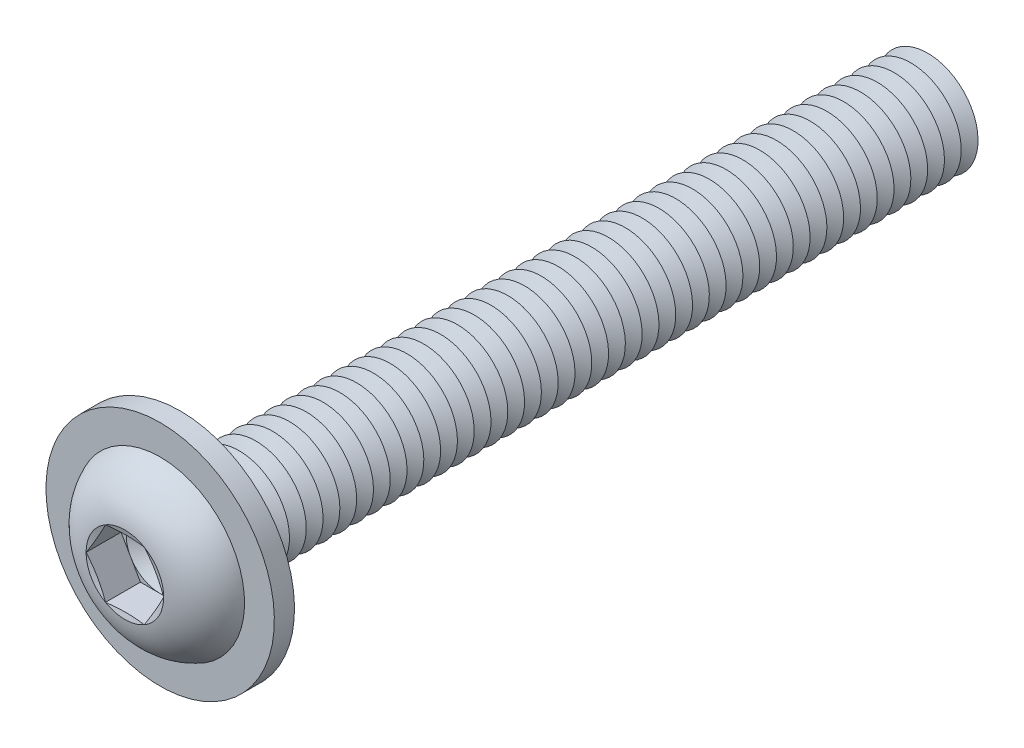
SolidWorks part; units mm, degrees
ref_plane "Front Plane" through (0, 0, 0) normal (0, 0, 1) x (1, 0, 0)
ref_plane "Top Plane" through (0, 0, 0) normal (0, 1, 0) x (1, 0, 0)
ref_plane "Right Plane" through (0, 0, 0) normal (1, 0, 0) x (0, 0, -1)
sketch "Sketch1" plane through (0, 0, 0) normal (1, 0, 0) x (0, 0, -1)
  line L0 (0, 3) -> (0, 5.25)
  line L3 (0, 3) -> (45, 3)
  line L4 (45, 3) -> (45, 0)
  line L5 (45, 0) -> (-3.3, 0) construction
  line L6 (-3.3, 0) -> (45, 0)
  line L7 (-3.3, 2.3094) -> (-3.3, 1.1547) construction
  line L8 (-3.3, 1.1547) -> (-3.3, 0)
  line L9 (-3.3, 2.3094) -> (-2.9906, 1.1547)
  line L10 (-2.9906, 1.1547) -> (-3.3, 1.1547)
  line L11 (45, 0) -> (22.7481, 0) construction
  line L12 (0, 5.25) -> (-3.3, 5.25) construction
  arc A1 (0, 5.25) -> (-3.3, 2.3094) centre (0, 1.928) ccw
  point P8 (45, 1.5)
  dimension "D1" = 10.5
  dimension "D2" = 6
  dimension "D3" = 3.3
  dimension "D4" = 4.6188
  dimension "D5" = 45
  dimension "D6" = 15
revolve "Revolve1" add sketch "Sketch1" angle 360 about L5
fillet "Fillet1" radius 0.5 1 edges at (0, 3, 0)
sketch "Sketch2" plane through (0, 0, 0) normal (1, 0, 0) x (0, 0, -1)
  line L0 (44.5, 3) -> (45.5, 3)
  line L1 (45, 3) -> (0.5, 3) construction
  line L2 (45.5, 3) -> (45, 2.134)
  line L3 (45, -3) -> (45, 3) construction
  line L4 (45, 2.134) -> (44.5, 3)
  dimension "D1" = 1
revolve "Cut-Revolve1" cut sketch "Sketch2" angle 360 about axis through (0, 0, -45) along (0, 0, -1)
pattern_linear "LPattern1" count 45 spacing 1 along (0, 0, 1) of "Cut-Revolve1"
sketch "Sketch3" plane through (0, 0, 3.3) normal (0, 0, 1) x (1, 0, 0)
  line L7 (1.1547, 2) -> (-1.1547, 2)
  line L8 (-1.1547, 2) -> (-2.3094, 0)
  line L9 (-2.3094, 0) -> (-1.1547, -2)
  line L10 (-1.1547, -2) -> (1.1547, -2)
  line L11 (1.1547, -2) -> (2.3094, 0)
  line L12 (2.3094, 0) -> (1.1547, 2)
  circle A0 centre (0, 0) radius 2 construction
  circle A3 centre (0, 0) radius 2.3094 construction
extrude "Cut-Extrude1" cut sketch "Sketch3" against normal blind 2.08
sketch "Sketch4" plane through (0, 0, 1.22) normal (0, 0, 1) x (1, 0, 0)
  line L1 (1.1547, 2) -> (-1.1547, 2) construction
  circle A0 centre (0, 0) radius 2
extrude "Cut-Extrude2" cut sketch "Sketch4" against normal through all draft 60
sketch "Sketch5" plane through (0, 0, 0) normal (0, 0, -1) x (-1, 0, 0)
  circle A0 centre (0, 0) radius 6.8
  circle A1 centre (0, 0) radius 3.5
  circle A2 centre (0, 0) radius 3.5 construction
  dimension "D1" = 13.6
extrude "Boss-Extrude1" add sketch "Sketch5" against normal blind 1.2
